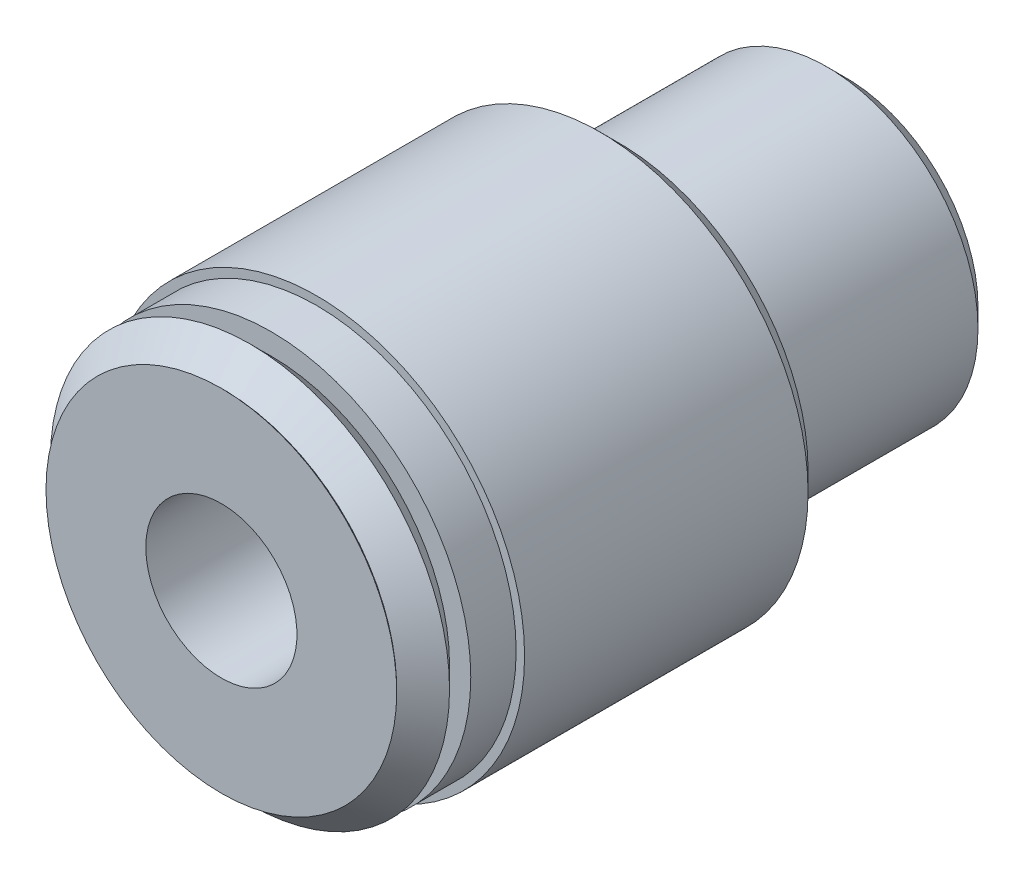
SolidWorks part; units mm, degrees
ref_plane "Front" through (0, 0, 0) normal (0, 0, 1) x (1, 0, 0)
ref_plane "Top" through (0, 0, 0) normal (0, 1, 0) x (1, 0, 0)
ref_plane "Right" through (0, 0, 0) normal (1, 0, 0) x (0, 0, -1)
ref_plane "Body Plane" through (0, 0, -3.9982) normal (0, 0, 1) x (1, 0, 0)
sketch "Sketch1" plane through (0, 0, 0) normal (1, 0, 0) x (0, 0, -1)
  line L0 (71.2941, 0) -> (-67.6458, 0) construction
  line L1 (0, 0) -> (0, 7.366)
  line L2 (0, 7.366) -> (0.0927, 7.2733)
  line L3 (0.0927, 7.2733) -> (1.2014, 8.382)
  line L4 (1.2014, 8.382) -> (2.0932, 7.4902)
  line L5 (2.0932, 7.4902) -> (2.0932, 8.382)
  line L6 (2.0932, 8.382) -> (3.9982, 8.382)
  line L7 (3.9982, 8.382) -> (3.9982, 0)
  line L8 (3.9982, 0) -> (0, 0)
  dimension "D1" = 45
  dimension "D2" = 8.382
  dimension "外径" = 8.382
  dimension "D4" = 0.8918
  dimension "D5" = 1.2014
  dimension "D6" = 7.366
  dimension "Front Length" = 1.905
revolve "Base" add sketch "Sketch1" angle 360 about L0
sketch "Sketch4" plane through (0, 0, -3.9982) normal (0, 0, 1) x (1, 0, 0)
  circle A0 centre (0, 0) radius 8.7376
  dimension "D1" = 17.4752
extrude "Double Acting Stud Body" add sketch "Sketch4" against normal blind 12.7
sketch "Sketch5" plane through (0, 0, -16.6982) normal (0, 0, -1) x (-1, 0, 0)
  circle A0 centre (0, 0) radius 6.35
  dimension "D1" = 12.7
extrude "Double Acting Stud Body 2" add sketch "Sketch5" along normal blind 9.525
chamfer "Double Acting Stud Chamfer" distance 0.7937 angle 45 2 edges at (8.7376, 0, -16.6982) (-6.35, 0, -26.2232)
sketch "Sketch8" plane through (0, 0, 0) normal (1, 0, 0) x (0, 0, -1)
  line L0 (15.9045, 0) -> (3.9982, 0) construction
  line L1 (3.9982, 8.7376) -> (3.9982, -8.7376) construction
  circle A0 centre (7.1732, 0) radius 2.032
  dimension "D1" = 4.064
  dimension "D2" = 3.175
extrude "Double Acting Stud Port A1" cut sketch "Sketch8" against normal through all
sketch "Sketch3" plane through (0, 0, 0) normal (0, 0, -1) x (-1, 0, 0)
  circle A0 centre (0, 0) radius 3.175
  dimension "杆径" = 6.35
extrude "Hole Cut" cut sketch "Sketch3" along normal through all
